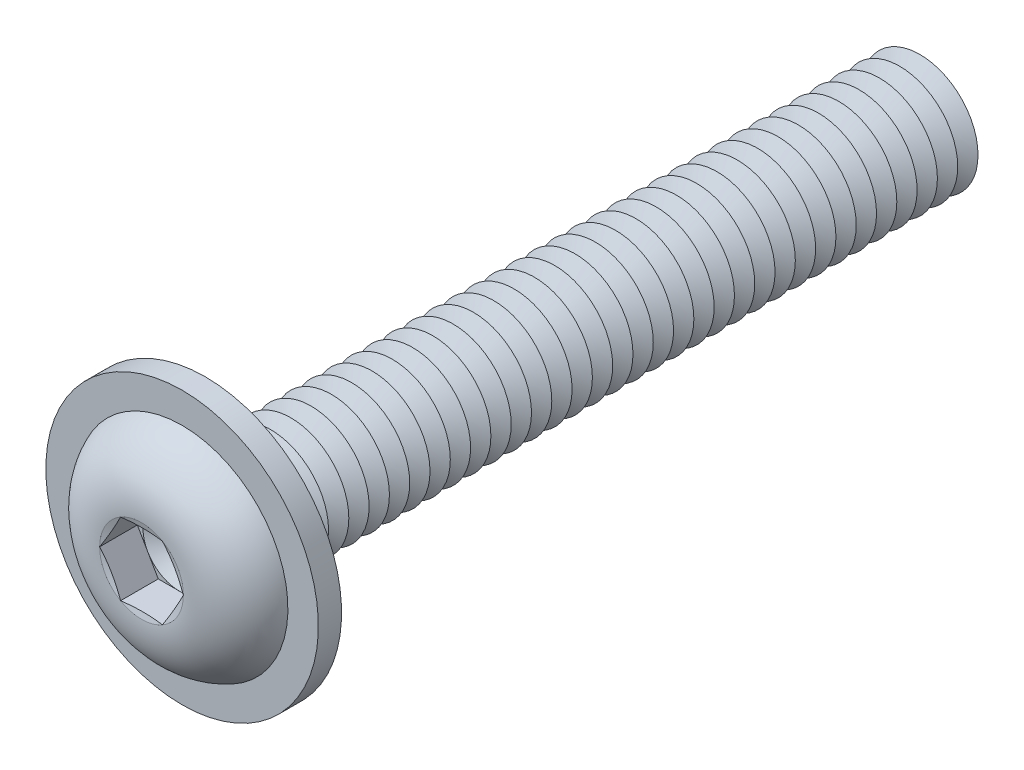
SolidWorks part; units mm, degrees
ref_plane "Front Plane" through (0, 0, 0) normal (0, 0, 1) x (1, 0, 0)
ref_plane "Top Plane" through (0, 0, 0) normal (0, 1, 0) x (1, 0, 0)
ref_plane "Right Plane" through (0, 0, 0) normal (1, 0, 0) x (0, 0, -1)
sketch "Sketch1" plane through (0, 0, 0) normal (1, 0, 0) x (0, 0, -1)
  line L0 (0, 2) -> (0, 3.8)
  line L3 (0, 2) -> (25, 2)
  line L4 (25, 2) -> (25, 0)
  line L5 (25, 0) -> (-2.2, 0) construction
  line L6 (-2.2, 0) -> (25, 0)
  line L7 (-2.2, 1.4434) -> (-2.2, 0.7217) construction
  line L8 (-2.2, 0.7217) -> (-2.2, 0)
  line L9 (-2.2, 1.4434) -> (-2.0066, 0.7217)
  line L10 (-2.0066, 0.7217) -> (-2.2, 0.7217)
  line L11 (25, 0) -> (22.7481, 0) construction
  line L12 (0, 3.8) -> (-2.2, 3.8) construction
  arc A1 (0, 3.8) -> (-2.2, 1.4434) centre (0, 1.5948) ccw
  point P8 (25, 1)
  dimension "D1" = 7.6
  dimension "D2" = 4
  dimension "D3" = 2.2
  dimension "D4" = 2.8868
  dimension "D5" = 25
  dimension "D6" = 15
revolve "Revolve1" add sketch "Sketch1" angle 360 about L5
fillet "Fillet1" radius 0.35 1 edges at (-2, 0, 0)
sketch "Sketch2" plane through (0, 0, 0) normal (1, 0, 0) x (0, 0, -1)
  line L0 (24.65, 2) -> (25.35, 2)
  line L1 (25, 2) -> (0.35, 2) construction
  line L2 (25.35, 2) -> (25, 1.3938)
  line L3 (25, -2) -> (25, 2) construction
  line L4 (25, 1.3938) -> (24.65, 2)
  dimension "D1" = 0.7
revolve "Cut-Revolve1" cut sketch "Sketch2" angle 360 about axis through (0, 0, -25) along (0, 0, -1)
pattern_linear "LPattern1" count 35 spacing 0.7 along (0, 0, 1) of "Cut-Revolve1"
sketch "Sketch3" plane through (0, 0, 2.2) normal (0, 0, 1) x (1, 0, 0)
  line L7 (0.7217, 1.25) -> (-0.7217, 1.25)
  line L8 (-0.7217, 1.25) -> (-1.4434, 0)
  line L9 (-1.4434, 0) -> (-0.7217, -1.25)
  line L10 (-0.7217, -1.25) -> (0.7217, -1.25)
  line L11 (0.7217, -1.25) -> (1.4434, 0)
  line L12 (1.4434, 0) -> (0.7217, 1.25)
  circle A0 centre (0, 0) radius 1.25 construction
  circle A3 centre (0, 0) radius 1.4434 construction
extrude "Cut-Extrude1" cut sketch "Sketch3" against normal blind 1.3
sketch "Sketch4" plane through (0, 0, 0.9) normal (0, 0, 1) x (1, 0, 0)
  line L1 (0.7217, 1.25) -> (-0.7217, 1.25) construction
  circle A0 centre (0, 0) radius 1.25
extrude "Cut-Extrude2" cut sketch "Sketch4" against normal through all draft 60
sketch "Sketch5" plane through (0, 0, 0) normal (0, 0, -1) x (-1, 0, 0)
  circle A0 centre (0, 0) radius 4.7
  circle A1 centre (0, 0) radius 2.35
  circle A2 centre (0, 0) radius 2.35 construction
  dimension "D1" = 9.4
extrude "Boss-Extrude1" add sketch "Sketch5" against normal blind 0.8
